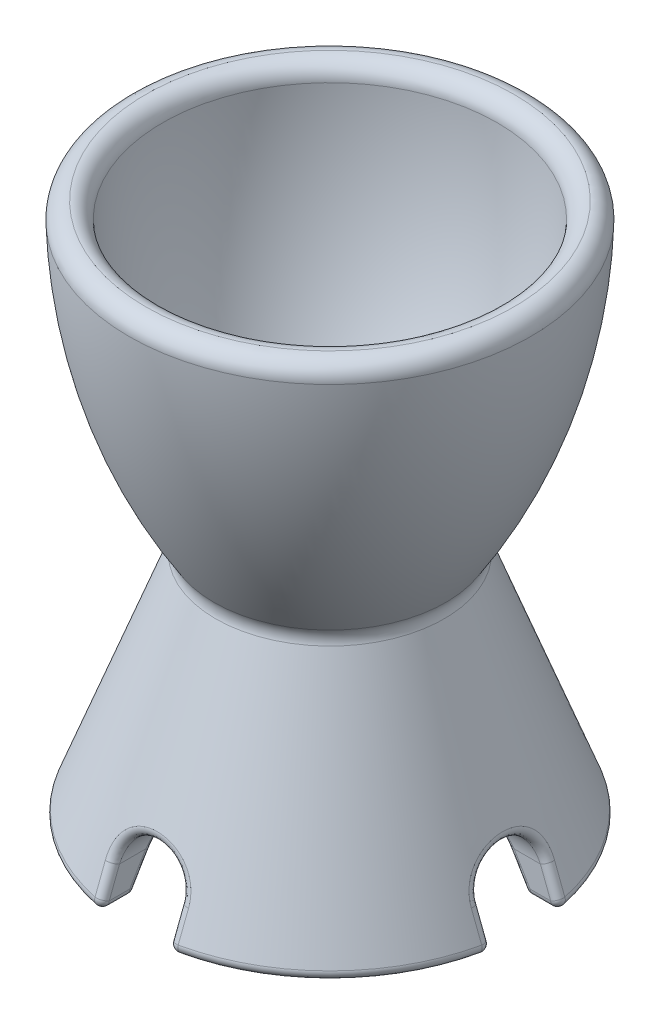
SolidWorks part; units mm, degrees
ref_plane "正面" through (0, 0, 0) normal (0, 0, 1) x (1, 0, 0)
ref_plane "平面" through (0, 0, 0) normal (0, 1, 0) x (1, 0, 0)
ref_plane "右側面" through (0, 0, 0) normal (1, 0, 0) x (0, 0, -1)
sketch "ｽｹｯﾁ1" plane through (0, 0, 0) normal (0, 0, 1) x (1, 0, 0)
  line L0 (0, 0) -> (-30, 0)
  line L1 (-30, 0) -> (0, 80)
  line L2 (0, 80) -> (0, 0)
  line L3 (0, -19.9786) -> (0, 141.7789) construction
  dimension "D1" = 80
  dimension "D2" = 60
revolve "回転1" add sketch "ｽｹｯﾁ1" angle 360 about L3
sketch "ｽｹｯﾁ2" plane through (0, 0, 0) normal (0, 0, 1) x (1, 0, 0)
  line L0 (0, -5.5802) -> (0, 90.1567) construction
  line L1 (0, 80) -> (30, 80)
  line L2 (0, 17.55) -> (0, 80)
  arc A0 (30, 80) -> (0, 17.55) centre (-50, 80) cw
  dimension "D1" = 80
  dimension "D2" = 60
revolve "回転2" add sketch "ｽｹｯﾁ2" angle 360 about L0
sketch "ｽｹｯﾁ3" plane through (0, 0, 0) normal (0, 0, 1) x (1, 0, 0)
  line L0 (0, -7.6829) -> (0, 89.4146) construction
  line L1 (13.4429, 40) -> (0, 40)
  line L2 (0, 40) -> (0, 80)
  line L3 (30, 80) -> (-30, 80) construction
  line L4 (0, 80) -> (25, 80)
  arc A2 (12.4499, 38.4668) -> (25, 80) centre (-50, 80) ccw
  arc A3 (13.4429, 40) -> (25, 80) centre (-50, 80) ccw
  dimension "D2" = 40
  dimension "D1" = 5
revolve "ｶｯﾄ - 回転1" cut sketch "ｽｹｯﾁ3" angle 360 about L0
sketch "ｽｹｯﾁ4" plane through (0, 0, 0) normal (0, -1, 0) x (1, 0, 0)
  circle A0 centre (0, 0) radius 25
  dimension "D1" = 50
extrude "ｶｯﾄ - 押し出し1" cut sketch "ｽｹｯﾁ4" against normal blind 20 draft 30
sketch "ｽｹｯﾁ5" plane through (0, 0, 0) normal (0, 0, 1) x (1, 0, 0)
  line L0 (0, -5.2091) -> (0, 20.6424) construction
  line L1 (-5, 5) -> (-5, 0)
  line L2 (-30, 0) -> (30, 0) construction
  line L3 (-5, 0) -> (5, 0)
  line L4 (5, 0) -> (5, 5)
  arc A0 (5, 5) -> (-5, 5) centre (0, 5) ccw
  dimension "D2" = 5
  dimension "D1" = 10
extrude "ｶｯﾄ - 押し出し2" cut sketch "ｽｹｯﾁ5" against normal through all and the other way through all
pattern_circular "円形ﾊﾟﾀｰﾝ1" count 2 every 90 of "ｶｯﾄ - 押し出し2"
fillet "ﾌｨﾚｯﾄ1" radius 2.5 4 edges at (0, 80, -25) (0, 80, -30) (0, 35.6979, 16.6133) (0, 40, -13.4429)
fillet "ﾌｨﾚｯﾄ2" radius 1 40 edges at (5, 0, -27.0376) (5, 0, 27.0376) (17.6777, 0, -17.6777) (-27.0376, 0, -5) (27.0376, 0, -5) (21.2132, 0, -21.2132) (0.6583, 9.9565, 26.2581) (-0.6583, 9.9565, -26.2581) (-0.551, 9.9695, 19.2362) (0.551, 9.9695, -19.2362) (-5, 0, -27.0376) (-5, 0, 27.0376) (-21.2132, 0, -21.2132) (-17.6777, 0, -17.6777) (-26.2581, 9.9565, 0.6583) (26.2581, 9.9565, -0.6583) (19.2362, 9.9695, 0.551) (-19.2362, 9.9695, -0.551) (21.2132, 0, 21.2132) (-27.0376, 0, 5) (27.0376, 0, 5) (17.6777, 0, 17.6777) (-17.6777, 0, 17.6777) (-21.2132, 0, 21.2132)
